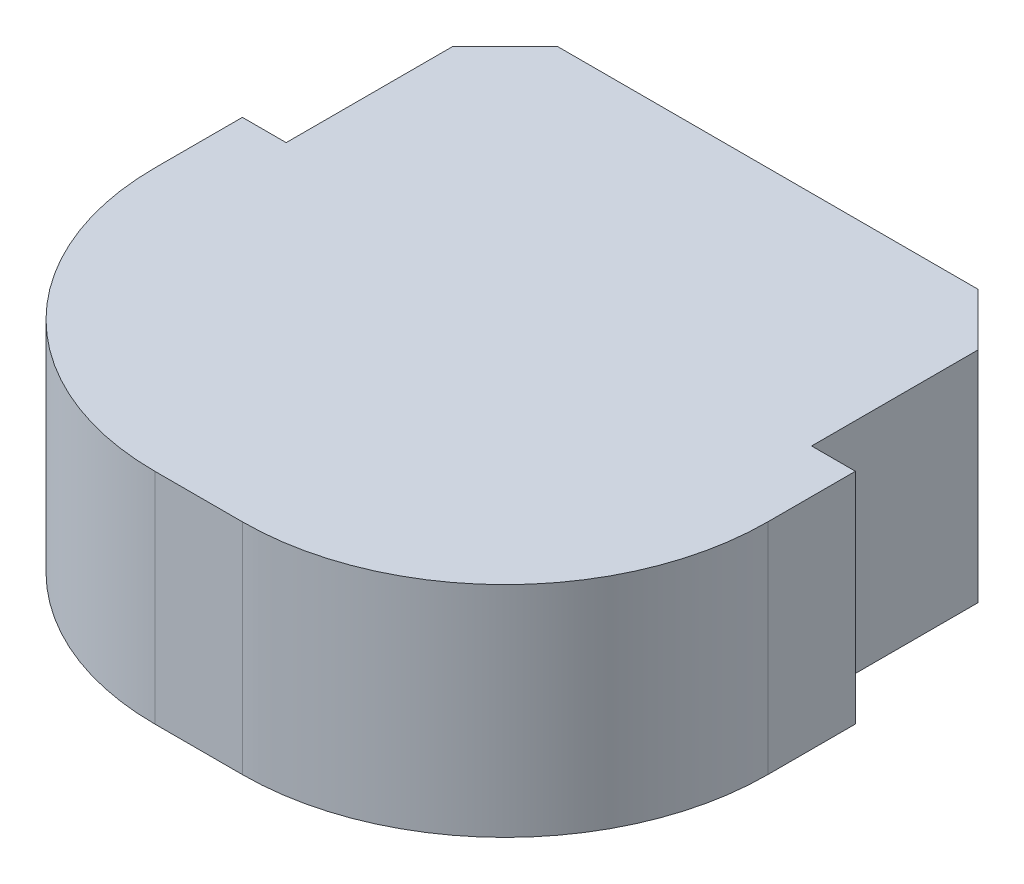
SolidWorks part; units mm, degrees
ref_plane "Front Plane" through (0, 0, 0) normal (0, 0, 1) x (1, 0, 0)
ref_plane "Top Plane" through (0, 0, 0) normal (0, 1, 0) x (1, 0, 0)
ref_plane "Right Plane" through (0, 0, 0) normal (1, 0, 0) x (0, 0, -1)
sketch "Sketch1" plane through (0, 0, 0) normal (0, 1, 0) x (1, 0, 0)
  line L1 (-4.445, 2.54) -> (4.445, 2.54)
  line L2 (-4.445, 2.54) -> (-4.445, -2.54)
  line L3 (-4.445, -2.54) -> (4.445, -2.54)
  line L4 (4.445, 2.54) -> (4.445, -2.54)
  line L5 (-4.445, 2.54) -> (4.445, -2.54) construction
  line L6 (-4.445, -2.54) -> (4.445, 2.54) construction
  point P0 (0, 0)
extrude "Boss-Extrude1" add sketch "Sketch1" along normal blind 3.175
sketch "Sketch2" plane through (0, 0, -2.54) normal (0, 0, -1) x (-1, 0, 0)
  line L0 (0, 3.175) -> (0, 0) construction
  line L1 (-4.445, 3.175) -> (4.445, 3.175) construction
  line L2 (-4.445, 0) -> (4.445, 0) construction
  line L3 (-3.81, 3.175) -> (3.81, 3.175)
  line L4 (-3.81, 3.175) -> (-3.81, 0)
  line L5 (-3.81, 0) -> (3.81, 0)
  line L6 (3.81, 3.175) -> (3.81, 0)
  line L7 (-3.81, 3.175) -> (3.81, 0) construction
  line L8 (-3.81, 0) -> (3.81, 3.175) construction
  point P5 (0, 1.5875)
  dimension "D1" = 7.62
extrude "Boss-Extrude2" add sketch "Sketch2" along normal blind 3.175
chamfer "Chamfer1" distance 0.762 angle 45 2 edges at (-3.81, 1.5875, -5.715) (3.81, 1.5875, -5.715)
fillet "Fillet1" radius 3.81 2 edges at (-4.445, 1.5875, 2.54) (4.445, 1.5875, 2.54)
sketch "Sketch3" plane through (0, 3.175, 0) normal (0, 1, 0) x (1, 0, 0)
  line L20 (-4.5466, 2.6416) -> (-4.5466, 1.27)
  line L21 (-0.635, -2.6416) -> (0.635, -2.6416)
  line L22 (4.5466, 1.27) -> (4.5466, 2.6416)
  line L23 (4.5466, 2.6416) -> (3.9116, 2.6416)
  line L24 (3.9116, 2.6416) -> (3.9116, 4.9951)
  line L25 (3.9116, 4.9951) -> (3.0901, 5.8166)
  line L26 (3.0901, 5.8166) -> (-3.0901, 5.8166)
  line L27 (-3.0901, 5.8166) -> (-3.9116, 4.9951)
  line L28 (-3.9116, 4.9951) -> (-3.9116, 2.6416)
  line L29 (-3.9116, 2.6416) -> (-4.5466, 2.6416)
  line L30 (-4.5466, 2.6416) -> (-4.5466, 1.27)
  line L31 (-0.635, -2.6416) -> (0.635, -2.6416)
  line L32 (4.5466, 1.27) -> (4.5466, 2.6416)
  line L33 (4.5466, 2.6416) -> (3.9116, 2.6416)
  line L34 (3.9116, 2.6416) -> (3.9116, 4.9951)
  line L35 (3.9116, 4.9951) -> (3.0901, 5.8166)
  line L36 (3.0901, 5.8166) -> (-3.0901, 5.8166)
  line L37 (-3.0901, 5.8166) -> (-3.9116, 4.9951)
  line L38 (-3.9116, 4.9951) -> (-3.9116, 2.6416)
  line L39 (-3.9116, 2.6416) -> (-4.5466, 2.6416)
  arc A4 (-4.5466, 1.27) -> (-0.635, -2.6416) centre (-0.635, 1.27) ccw
  arc A5 (0.635, -2.6416) -> (4.5466, 1.27) centre (0.635, 1.27) ccw
  arc A6 (-4.5466, 1.27) -> (-0.635, -2.6416) centre (-0.635, 1.27) ccw
  arc A7 (0.635, -2.6416) -> (4.5466, 1.27) centre (0.635, 1.27) ccw
equation "\"D2@Sketch1\"=.2"
equation "\"D1@Boss-Extrude1\"=\"t\""
equation "\"t\"= .125'plywood thickness"
equation "\"kerf\"= .004in'Kerf for laser cutter"
equation "\"D1@Boss-Extrude2\"=\"t\""
equation "\"D1@Sketch3\"=\"kerf\""
